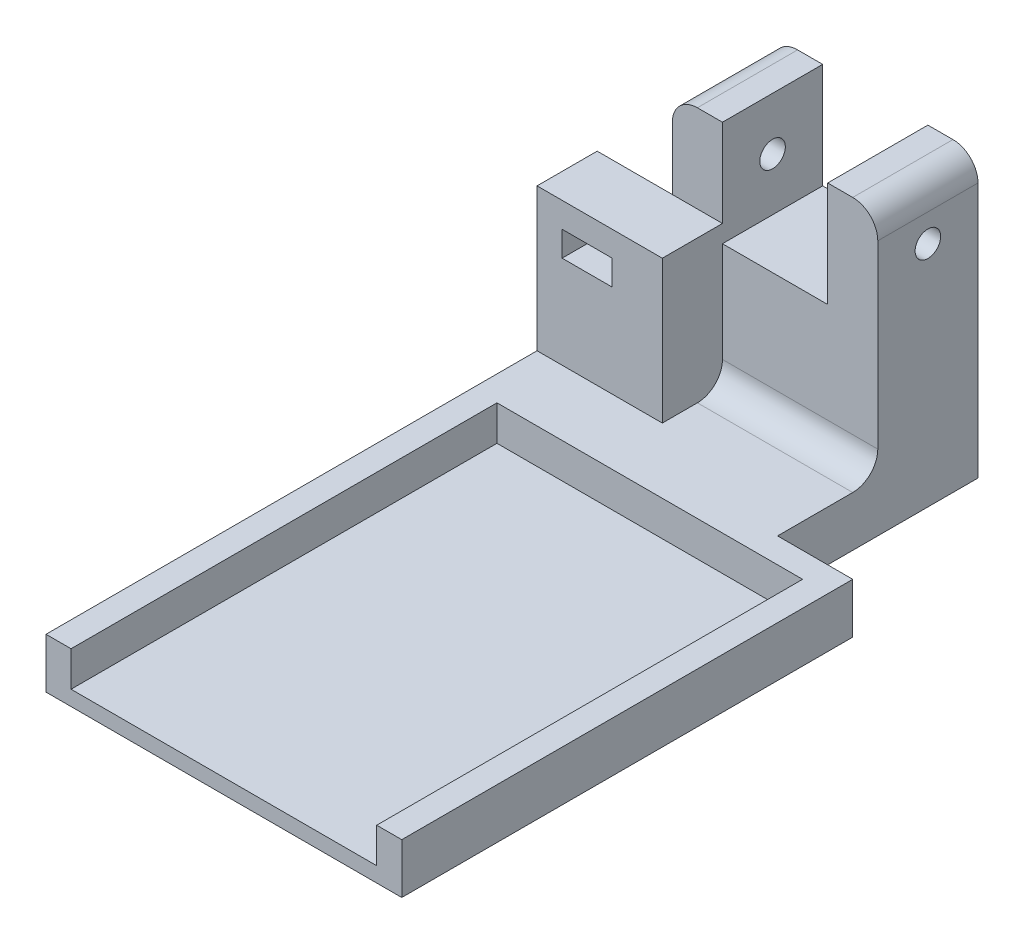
SolidWorks part; units mm, degrees
ref_plane "Front Plane" through (0, 0, 0) normal (0, 0, 1) x (1, 0, 0)
ref_plane "Top Plane" through (0, 0, 0) normal (0, 1, 0) x (1, 0, 0)
ref_plane "Right Plane" through (0, 0, 0) normal (1, 0, 0) x (0, 0, -1)
sketch "Sketch1" plane through (0, 0, 0) normal (0, 0, 1) x (1, 0, 0)
  line L10 (-0.5, -0.5) -> (20.5, -0.5)
  line L13 (20.5, 20.5) -> (20.5, -0.5)
  line L17 (-10.5, 20.5) -> (-10.5, -35.5)
  line L19 (30.5, -35.5) -> (30.5, 20.5)
  line L21 (-0.5, 20.5) -> (-0.5, -0.5)
  line L22 (-10.5, -35.5) -> (30.5, -35.5)
  line L23 (-10.5, 20.5) -> (-0.5, 20.5)
  line L24 (20.5, 20.5) -> (30.5, 20.5)
extrude "Boss-Extrude1" add sketch "Sketch1" along normal blind 20
sketch "Sketch3" plane through (0, 0, 20) normal (0, 0, 1) x (1, 0, 0)
  line L0 (30.5, -35.5) -> (30.5, 20.5) construction
  line L10 (-10.5, -35.5) -> (30.5, -35.5)
  line L11 (-10.5, -35.5) -> (-10.5, -25.5)
  line L12 (-10.5, -25.5) -> (30.5, -25.5)
  line L13 (30.5, -35.5) -> (30.5, -25.5)
extrude "Boss-Extrude3" add sketch "Sketch3" along normal blind 110
sketch "Sketch18" plane through (-10.5, 0, 0) normal (-1, 0, 0) x (0, 0, 1)
  line L6 (130, -25.5) -> (20, -25.5) construction
  line L7 (130, -35.5) -> (40, -35.5)
  line L8 (130, -35.5) -> (130, -25.5)
  line L9 (130, -25.5) -> (40, -25.5)
  line L10 (40, -35.5) -> (40, -25.5)
extrude "Boss-Extrude4" add sketch "Sketch18" along normal blind 15
sketch "Sketch19" plane through (30.5, 0, 0) normal (1, 0, 0) x (0, 0, -1)
  line L6 (-130, -25.5) -> (-20, -25.5) construction
  line L7 (-130, -35.5) -> (-40, -35.5)
  line L8 (-130, -35.5) -> (-130, -25.5)
  line L9 (-130, -25.5) -> (-40, -25.5)
  line L10 (-40, -35.5) -> (-40, -25.5)
extrude "Boss-Extrude5" add sketch "Sketch19" along normal blind 15
sketch "Sketch20" plane through (0, -25.5, 0) normal (0, 1, 0) x (1, 0, 0)
  line L5 (-20.5, -45) -> (-20.5, -125)
  line L14 (40.5, -45) -> (-20.5, -45)
  line L16 (40.5, -125) -> (40.5, -45)
  line L18 (40.5, -125) -> (-20.5, -125)
extrude "Cut-Extrude3" cut sketch "Sketch20" against normal blind 7 contours L16 L14 L5 L18
sketch "Sketch21" plane through (0, 0, 125) normal (0, 0, -1) x (-1, 0, 0)
  line L0 (-40.5, -32.5) -> (20.5, -32.5) construction
  line L6 (20.5, -32.5) -> (-40.5, -32.5)
  line L7 (20.5, -32.5) -> (20.5, -25.5)
  line L8 (20.5, -25.5) -> (-40.5, -25.5)
  line L9 (-40.5, -32.5) -> (-40.5, -25.5)
extrude "Cut-Extrude4" cut sketch "Sketch21" against normal blind 7
sketch "Sketch24" plane through (-10.5, 0, 0) normal (-1, 0, 0) x (0, 0, 1)
  line L37 (20, -25.5) -> (32, -25.5)
  line L38 (40, -25.5) -> (20, -25.5) construction
  line L39 (32, -25.5) -> (32, 3)
  line L41 (20, 3) -> (20, -25.5)
  line L43 (20, 3) -> (32, 3)
extrude "Boss-Extrude6" add sketch "Sketch24" against normal blind 10
sketch "Sketch26" plane through (-10.5, 0, 0) normal (-1, 0, 0) x (0, 0, 1)
  line L0 (40, -35.5) -> (0, -35.5) construction
  line L9 (20, 3) -> (32, 3)
  line L14 (20, 3) -> (20, -25.5)
  line L16 (32, 3) -> (32, -25.5)
  line L18 (20, -25.5) -> (20, -35.5)
  line L19 (20, -35.5) -> (32, -35.5)
  line L21 (32, -25.5) -> (40, -25.5)
  line L22 (40, -25.5) -> (40, -35.5)
  line L23 (40, -35.5) -> (32, -35.5)
extrude "Boss-Extrude8" add sketch "Sketch26" along normal blind 15
sketch "Sketch11" plane through (-10.5, 0, 0) normal (-1, 0, 0) x (0, 0, 1)
  circle A2 centre (10, 10) radius 2.55
  circle A3 centre (30, 10) radius 2.55
extrude "Cut-Extrude1" cut sketch "Sketch11" against normal through all
sketch "Sketch27" plane through (0, 0, 32) normal (0, 0, 1) x (1, 0, 0)
  line L0 (-10.5, -2) -> (-10.5, -7)
  line L2 (-20.5, -2) -> (-10.5, -2)
  line L5 (-10.5, -7) -> (-20.5, -7)
  line L8 (-20.5, -2) -> (-20.5, -7)
extrude "Cut-Extrude5" cut sketch "Sketch27" against normal through all
fillet "Fillet1" radius 5 3 edges at (15, -25.5, 20) (-10.5, 20.5, 10) (30.5, 20.5, 10)
